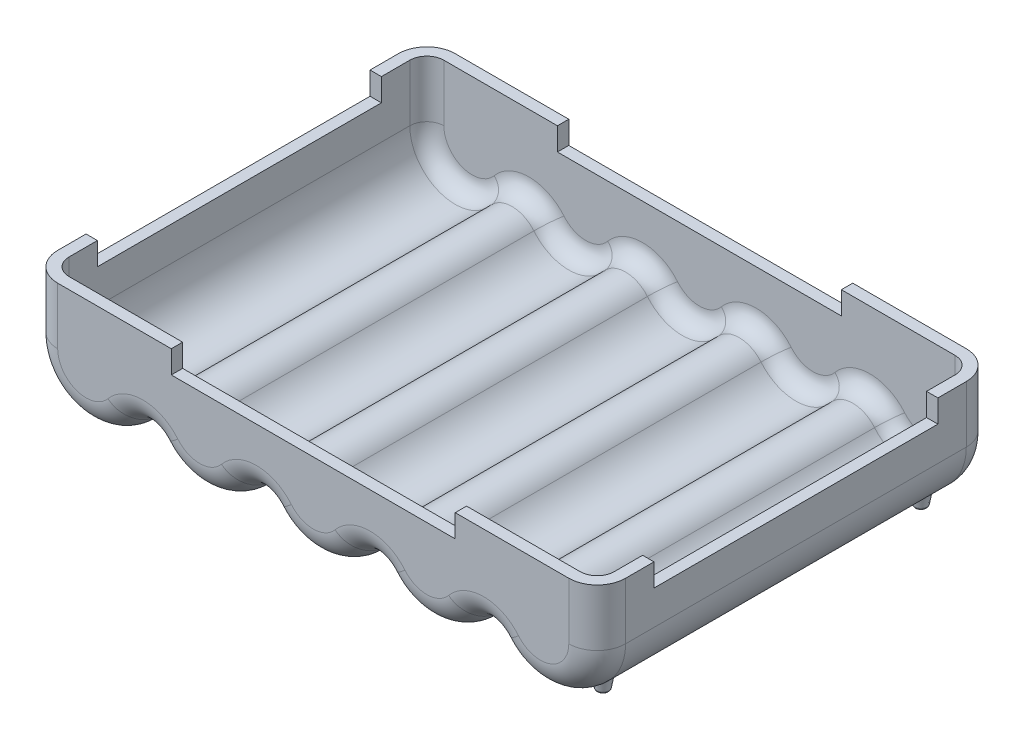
SolidWorks part; units mm, degrees
ref_plane "Front Plane" through (0, 0, 0) normal (0, 0, 1) x (1, 0, 0)
ref_plane "Top Plane" through (0, 0, 0) normal (0, 1, 0) x (1, 0, 0)
ref_plane "Right Plane" through (0, 0, 0) normal (1, 0, 0) x (0, 0, -1)
sketch "Sketch1" plane through (0, 0, 0) normal (0, 0, 1) x (1, 0, 0)
  line L1 (-25, 0) -> (25, 0)
  line L2 (-25, 0) -> (-25, -5)
  line L4 (25, 0) -> (25, -5)
  arc A0 (-16.1538, -8.1949) -> (-25, -5) centre (-20, -5) cw
  arc A1 (-6.1538, -8.1949) -> (-13.8462, -8.1949) centre (-10, -5) cw
  arc A2 (3.8462, -8.1949) -> (-3.8462, -8.1949) centre (0, -5) cw
  arc A3 (13.8462, -8.1949) -> (6.1538, -8.1949) centre (10, -5) cw
  arc A4 (25, -5) -> (16.1538, -8.1949) centre (20, -5) cw
  arc A5 (13.8462, -8.1949) -> (16.1538, -8.1949) centre (15, -9.1533) cw
  arc A6 (3.8462, -8.1949) -> (6.1538, -8.1949) centre (5, -9.1533) cw
  arc A7 (-6.1538, -8.1949) -> (-3.8462, -8.1949) centre (-5, -9.1533) cw
  arc A8 (-13.8462, -8.1949) -> (-16.1538, -8.1949) centre (-15, -9.1533) ccw
  point P4 (0, 0)
  point P24 (-15, -5)
  dimension "D3" = 5
  dimension "D5" = 1.5
  dimension "D6" = 1.5
  dimension "D7" = 1.5
  dimension "D8" = 1.5
  dimension "D1" = 50
  dimension "D2" = 5
  dimension "D4" = 5
extrude "Boss-Extrude1" add sketch "Sketch1" along normal mid plane 35
fillet "Fillet1" radius 2.5 22 edges at (-25, -2.5, -17.5) (-21.6984, -9.7027, -17.5) (-15, -7.6533, -17.5) (-10, -10, -17.5) (-5, -7.6533, -17.5) (25, -2.5, -17.5) (21.6984, -9.7027, -17.5) (15, -7.6533, -17.5) (10, -10, -17.5) (5, -7.6533, -17.5) (-25, -2.5, 17.5) (-21.6984, -9.7027, 17.5) (-15, -7.6533, 17.5) (-10, -10, 17.5) (-5, -7.6533, 17.5) (25, -2.5, 17.5) (21.6984, -9.7027, 17.5) (15, -7.6533, 17.5) (10, -10, 17.5) (5, -7.6533, 17.5) (0, -10, -17.5) (0, -10, 17.5)
shell "Shell1" thickness 1
sketch "Sketch2" plane through (0, 0, 0) normal (0, 0, 1) x (1, 0, 0)
  line L1 (-12.5, 2) -> (12.5, 2)
  line L2 (-12.5, 2) -> (-12.5, -2)
  line L3 (-12.5, -2) -> (12.5, -2)
  line L4 (12.5, 2) -> (12.5, -2)
  line L5 (-12.5, 2) -> (12.5, -2) construction
  line L6 (-12.5, -2) -> (12.5, 2) construction
  point P0 (0, 0)
  dimension "D1" = 25
  dimension "D2" = 4
extrude "Cut-Extrude1" cut sketch "Sketch2" against normal through all both and the other way through all
sketch "Sketch4" plane through (25, 0, 0) normal (1, 0, 0) x (0, 0, -1)
  line L0 (-15, 0) -> (15, 0) construction
  line L1 (-12.5, 2) -> (12.5, 2)
  line L2 (-12.5, 2) -> (-12.5, -2)
  line L3 (-12.5, -2) -> (12.5, -2)
  line L4 (12.5, 2) -> (12.5, -2)
  line L5 (-12.5, 2) -> (12.5, -2) construction
  line L6 (-12.5, -2) -> (12.5, 2) construction
  point P0 (0, 0)
  point P9 (0, 0)
  dimension "D1" = 25
  dimension "D2" = 4
extrude "Cut-Extrude2" cut sketch "Sketch4" against normal through all
sketch "Sketch5" plane through (0, 0, 0) normal (0, 1, 0) x (1, 0, 0)
  line L0 (-25, -12.5) -> (-25, 12.5) construction
  line L1 (-21, 12.5) -> (-20, 12.5)
  line L2 (-21.5, 12) -> (-21.5, -12)
  line L3 (-21, -12.5) -> (-20, -12.5)
  line L4 (-19.5, 12) -> (-19.5, -12)
  line L5 (-12.5, 17.5) -> (-22.5, 17.5) construction
  line L6 (-11.25, 12) -> (-11.25, -12)
  line L7 (-10.75, 12.5) -> (-9.75, 12.5)
  line L8 (-9.25, 12) -> (-9.25, -12)
  line L9 (-10.75, -12.5) -> (-9.75, -12.5)
  line L10 (-1, 12) -> (-1, -12)
  line L11 (-0.5, 12.5) -> (0.5, 12.5)
  line L12 (1, 12) -> (1, -12)
  line L13 (-0.5, -12.5) -> (0.5, -12.5)
  line L14 (9.25, 12) -> (9.25, -12)
  line L15 (9.75, 12.5) -> (10.75, 12.5)
  line L16 (11.25, 12) -> (11.25, -12)
  line L17 (9.75, -12.5) -> (10.75, -12.5)
  line L18 (19.5, 12) -> (19.5, -12)
  line L19 (20, 12.5) -> (21, 12.5)
  line L20 (21.5, 12) -> (21.5, -12)
  line L21 (20, -12.5) -> (21, -12.5)
  arc A0 (-21, -12.5) -> (-21.5, -12) centre (-21, -12) cw
  arc A1 (-19.5, -12) -> (-20, -12.5) centre (-20, -12) cw
  arc A2 (-20, 12.5) -> (-19.5, 12) centre (-20, 12) cw
  arc A3 (-21, 12.5) -> (-21.5, 12) centre (-21, 12) ccw
  arc A4 (20, -12.5) -> (19.5, -12) centre (20, -12) cw
  arc A5 (21.5, -12) -> (21, -12.5) centre (21, -12) cw
  arc A6 (21, 12.5) -> (21.5, 12) centre (21, 12) cw
  arc A7 (20, 12.5) -> (19.5, 12) centre (20, 12) ccw
  arc A8 (9.75, 12.5) -> (9.25, 12) centre (9.75, 12) ccw
  arc A9 (11.25, 12) -> (10.75, 12.5) centre (10.75, 12) ccw
  arc A10 (10.75, -12.5) -> (11.25, -12) centre (10.75, -12) ccw
  arc A11 (9.75, -12.5) -> (9.25, -12) centre (9.75, -12) cw
  arc A12 (-0.5, -12.5) -> (-1, -12) centre (-0.5, -12) cw
  arc A13 (1, -12) -> (0.5, -12.5) centre (0.5, -12) cw
  arc A14 (0.5, 12.5) -> (1, 12) centre (0.5, 12) cw
  arc A15 (-0.5, 12.5) -> (-1, 12) centre (-0.5, 12) ccw
  arc A16 (-10.75, -12.5) -> (-11.25, -12) centre (-10.75, -12) cw
  arc A17 (-9.25, -12) -> (-9.75, -12.5) centre (-9.75, -12) cw
  arc A18 (-9.75, 12.5) -> (-9.25, 12) centre (-9.75, 12) cw
  arc A19 (-10.75, 12.5) -> (-11.25, 12) centre (-10.75, 12) ccw
  point P26 (-21.5, -12.5)
  point P31 (-19.5, 12.5)
  point P34 (-21.5, 12.5)
  dimension "D6" = 0.5
  dimension "D7" = 0.5
  dimension "D8" = 0.5
  dimension "D9" = 0.5
  dimension "D10" = 0.5
  dimension "D11" = 0.5
  dimension "D12" = 0.5
  dimension "D13" = 0.5
  dimension "D14" = 0.5
  dimension "D15" = 0.5
  dimension "D16" = 0.5
  dimension "D17" = 0.5
  dimension "D18" = 0.5
  dimension "D19" = 0.5
  dimension "D20" = 0.5
  dimension "D21" = 0.5
  dimension "D22" = 0.5
  dimension "D23" = 0.5
  dimension "D24" = 0.5
  dimension "D25" = 0.5
  dimension "D1" = 25
  dimension "D2" = 2
  dimension "D3" = 3.5
  dimension "D4" = 5
  dimension "D5" = 5
ref_plane "Plane1" through (0, -10.5, 0) normal (0, 1, 0) x (1, 0, 0)
sketch "Sketch6" plane through (0, -10.5, 0) normal (0, 1, 0) x (1, 0, 0)
  line L0 (-25, -15) -> (-25, 15) construction
  line L1 (-18.0769, -17.5) -> (-11.9231, -17.5) construction
  line L2 (18.0769, -17.5) -> (22.5, -17.5) construction
  line L3 (25, -15) -> (25, 15) construction
  line L4 (22.5, 17.5) -> (18.0769, 17.5) construction
  line L5 (-18.0769, 17.5) -> (-22.5, 17.5) construction
  circle A0 centre (-22, -14) radius 0.5
  circle A1 centre (22, -14) radius 0.5
  circle A2 centre (22, 14) radius 0.5
  circle A3 centre (-22, 14) radius 0.5
  dimension "D1" = 1
  dimension "D2" = 3
  dimension "D3" = 3.5
  dimension "D5" = 3
  dimension "D6" = 3
  dimension "D7" = 3.5
  dimension "D8" = 3
  dimension "D9" = 3.5
  dimension "D4" = 3.5
extrude "Boss-Extrude2" add sketch "Sketch6" along normal up to next draft 10
fillet "Fillet2" radius 0.25 4 edges at (-22, -10.5, -13.5) (-22, -10.5, 14.5) (22, -10.5, 14.5) (22, -10.5, -13.5)
scale "Scale1" bodies to scale 105 scale about centroid uniform scaling yes scale factor 1
